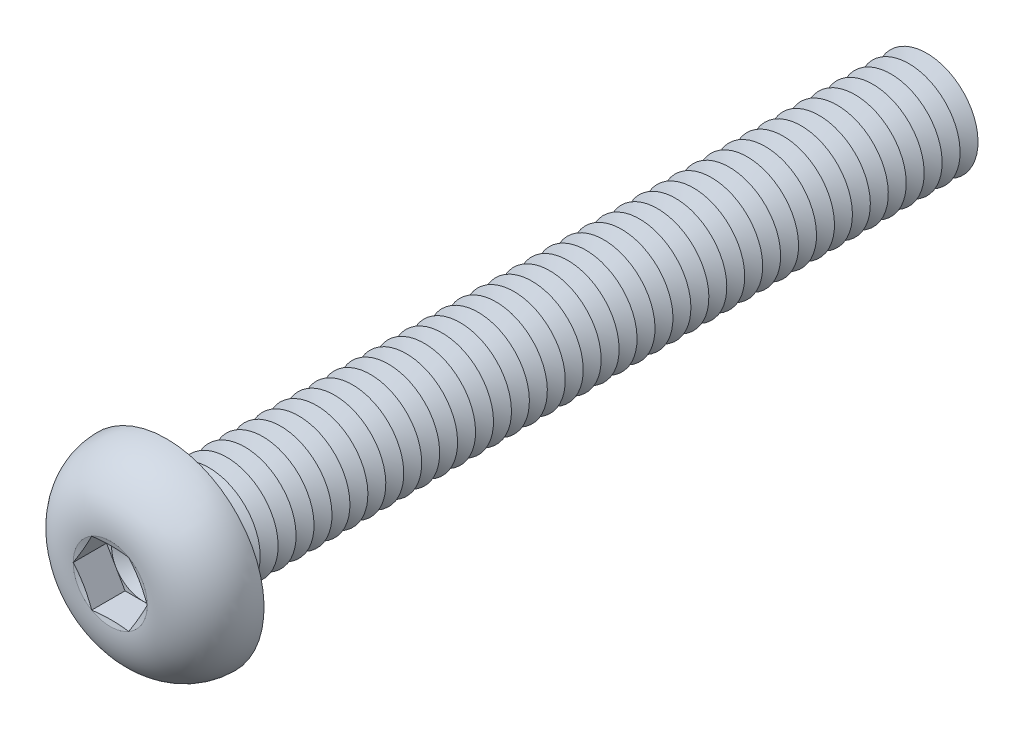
SolidWorks part; units mm, degrees
ref_plane "Front Plane" through (0, 0, 0) normal (0, 0, 1) x (1, 0, 0)
ref_plane "Top Plane" through (0, 0, 0) normal (0, 1, 0) x (1, 0, 0)
ref_plane "Right Plane" through (0, 0, 0) normal (1, 0, 0) x (0, 0, -1)
sketch "Sketch1" plane through (0, 0, 0) normal (1, 0, 0) x (0, 0, -1)
  line L0 (0, 2) -> (0, 3.8)
  line L3 (0, 2) -> (30, 2)
  line L4 (30, 2) -> (30, 0)
  line L5 (30, 0) -> (-2.2, 0) construction
  line L6 (-2.2, 0) -> (30, 0)
  line L7 (-2.2, 1.4434) -> (-2.2, 0.7217) construction
  line L8 (-2.2, 0.7217) -> (-2.2, 0)
  line L9 (-2.2, 1.4434) -> (-2.0066, 0.7217)
  line L10 (-2.0066, 0.7217) -> (-2.2, 0.7217)
  line L11 (30, 0) -> (22.7481, 0) construction
  line L12 (0, 3.8) -> (-2.2, 3.8) construction
  arc A1 (0, 3.8) -> (-2.2, 1.4434) centre (0, 1.5948) ccw
  point P8 (30, 1)
  dimension "D1" = 7.6
  dimension "D2" = 4
  dimension "D3" = 2.2
  dimension "D4" = 2.8868
  dimension "D5" = 30
  dimension "D6" = 15
revolve "Revolve1" add sketch "Sketch1" angle 360 about L5
fillet "Fillet1" radius 0.35 1 edges at (0, 2, 0)
sketch "Sketch2" plane through (0, 0, 0) normal (1, 0, 0) x (0, 0, -1)
  line L0 (29.65, 2) -> (30.35, 2)
  line L1 (30, 2) -> (0.35, 2) construction
  line L2 (30.35, 2) -> (30, 1.3938)
  line L3 (30, -2) -> (30, 2) construction
  line L4 (30, 1.3938) -> (29.65, 2)
  dimension "D1" = 0.7
revolve "Cut-Revolve1" cut sketch "Sketch2" angle 360 about axis through (0, 0, -30) along (0, 0, -1)
pattern_linear "LPattern1" count 42 spacing 0.7 along (0, 0, 1) of "Cut-Revolve1"
sketch "Sketch3" plane through (0, 0, 2.2) normal (0, 0, 1) x (1, 0, 0)
  line L7 (0.7217, 1.25) -> (-0.7217, 1.25)
  line L8 (-0.7217, 1.25) -> (-1.4434, 0)
  line L9 (-1.4434, 0) -> (-0.7217, -1.25)
  line L10 (-0.7217, -1.25) -> (0.7217, -1.25)
  line L11 (0.7217, -1.25) -> (1.4434, 0)
  line L12 (1.4434, 0) -> (0.7217, 1.25)
  circle A0 centre (0, 0) radius 1.25 construction
  circle A3 centre (0, 0) radius 1.4434 construction
extrude "Cut-Extrude1" cut sketch "Sketch3" against normal blind 1.3
sketch "Sketch4" plane through (0, 0, 0.9) normal (0, 0, 1) x (1, 0, 0)
  line L1 (0.7217, 1.25) -> (-0.7217, 1.25) construction
  circle A0 centre (0, 0) radius 1.25
extrude "Cut-Extrude2" cut sketch "Sketch4" against normal through all draft 60
